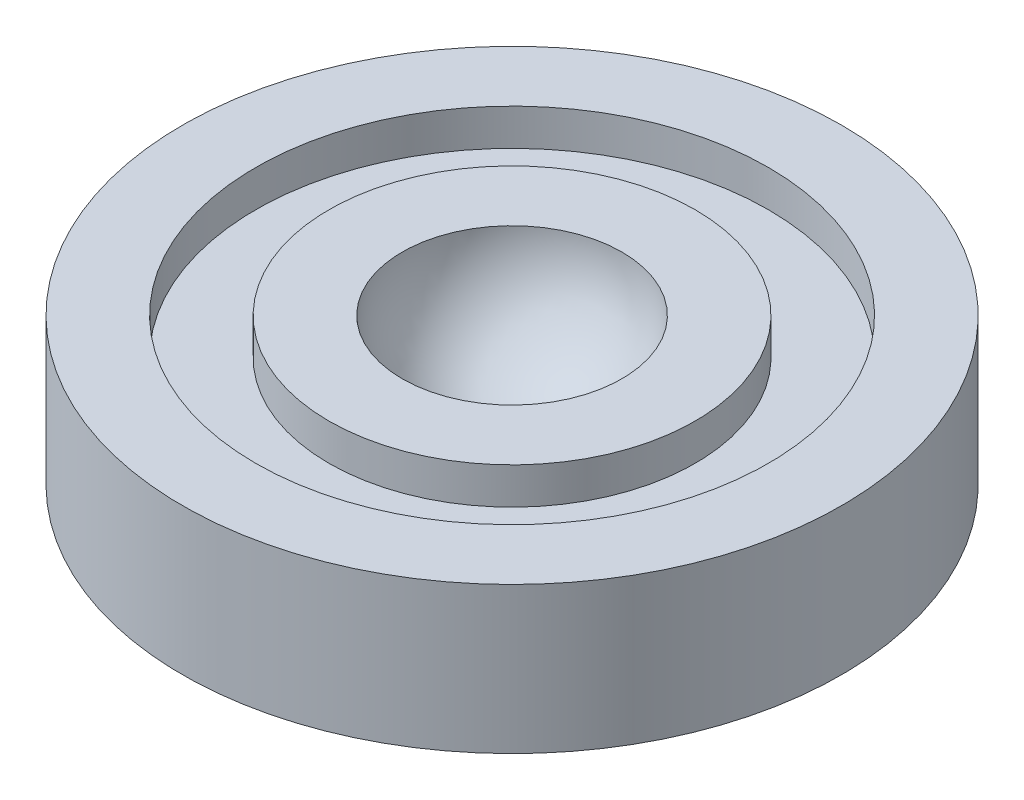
SolidWorks part; units mm, degrees
ref_plane "Ebene vorne" through (0, 0, 0) normal (0, 0, 1) x (1, 0, 0)
ref_plane "Ebene oben" through (0, 0, 0) normal (0, 1, 0) x (1, 0, 0)
ref_plane "Ebene rechts" through (0, 0, 0) normal (1, 0, 0) x (0, 0, -1)
sketch "Skizze1" plane through (0, 0, 0) normal (1, 0, 0) x (0, 0, -1)
  line L0 (0, 0) -> (0, 6.4386) construction
  line L1 (0, 6.4386) -> (0, -6.4386) construction
  line L2 (-15, 0) -> (-25, 0)
  line L3 (-25, 0) -> (-25, -5)
  line L4 (-25, -5) -> (-35, -5)
  line L5 (-35, -5) -> (-35, 0)
  line L6 (-35, 0) -> (-45, 0)
  line L7 (-45, 0) -> (-45, -13.1489)
  line L8 (-45, -13.1489) -> (-45, -20)
  line L9 (-45, -20) -> (0, -20)
  line L10 (0, -20) -> (0, -15)
  arc A0 (-15, 0) -> (0, -15) centre (0, 0) ccw
revolve "Rotation1" add sketch "Skizze1" angle 360 about L0
